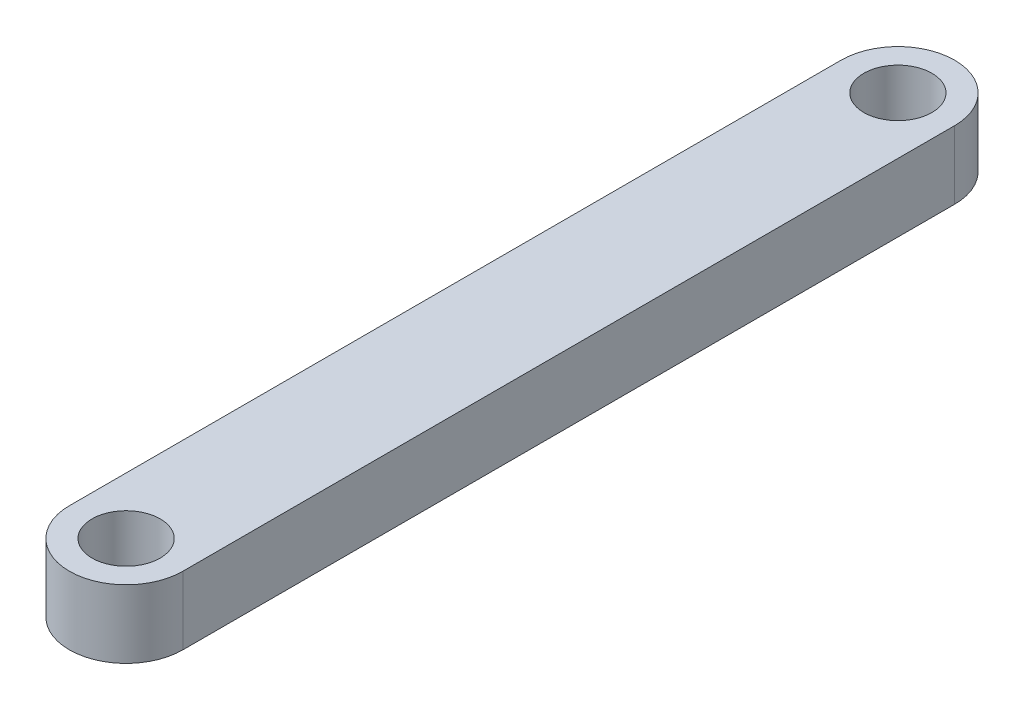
SolidWorks part; units mm, degrees
ref_plane "Front Plane" through (0, 0, 0) normal (0, 0, 1) x (1, 0, 0)
ref_plane "Top Plane" through (0, 0, 0) normal (0, 1, 0) x (1, 0, 0)
ref_plane "Right Plane" through (0, 0, 0) normal (1, 0, 0) x (0, 0, -1)
sketch "Sketch1" plane through (0, 0, 0) normal (0, 1, 0) x (1, 0, 0)
  line L0 (0, 34) -> (0, 0) construction
  line L1 (2.5, 34) -> (2.5, 0)
  line L2 (-2.5, 34) -> (-2.5, 0)
  circle A0 centre (0, 0) radius 1.5
  circle A1 centre (0, 34) radius 1.5
  arc A2 (2.5, 34) -> (-2.5, 34) centre (0, 34) ccw
  arc A3 (-2.5, 0) -> (2.5, 0) centre (0, 0) ccw
  point P5 (0, 17)
  dimension "D1" = 3
  dimension "D2" = 3
  dimension "D4" = 2.5
  dimension "D3" = 34
extrude "Boss-Extrude1" add sketch "Sketch1" along normal blind 3
